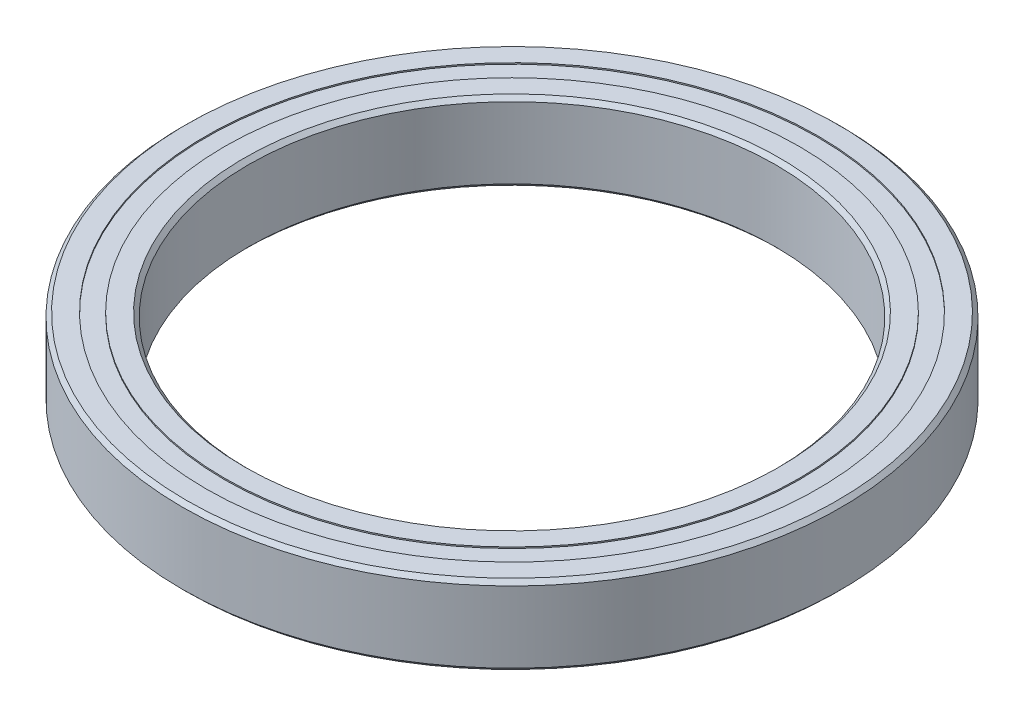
SolidWorks part; units mm, degrees
ref_plane "前视基准面" through (0, 0, 0) normal (0, 0, 1) x (1, 0, 0)
ref_plane "上视基准面" through (0, 0, 0) normal (0, 1, 0) x (1, 0, 0)
ref_plane "右视基准面" through (0, 0, 0) normal (1, 0, 0) x (0, 0, -1)
sketch "草图1" plane through (0, 0, 0) normal (0, 1, 0) x (1, 0, 0)
  circle A0 centre (0, 0) radius 20
  circle A1 centre (0, 0) radius 25
  dimension "D1" = 40
  dimension "D2" = 50
extrude "凸台-拉伸1" add sketch "草图1" along normal blind 6
chamfer "倒角1" distance 0.3 angle 45 4 edges at (0, 0, 20) (0, 0, 25) (0, 6, 20) (0, 6, 25)
sketch "草图2" plane through (0, 6, 0) normal (0, 1, 0) x (1, 0, 0)
  circle A0 centre (0, 0) radius 21.8
  circle A1 centre (0, 0) radius 23.2
  circle A2 centre (0, 0) radius 25 construction
  circle A3 centre (0, 0) radius 20 construction
  dimension "D1" = 1.8
  dimension "D2" = 1.8
extrude "切除-拉伸1" cut sketch "草图2" against normal blind 0.1
sketch "草图3" plane through (0, 0, 0) normal (0, -1, 0) x (1, 0, 0)
  circle A0 centre (0, 0) radius 21.8 construction
  circle A1 centre (0, 0) radius 23.2 construction
  circle A2 centre (0, 0) radius 21.8
  circle A3 centre (0, 0) radius 23.2
extrude "切除-拉伸2" cut sketch "草图3" against normal blind 0.1
